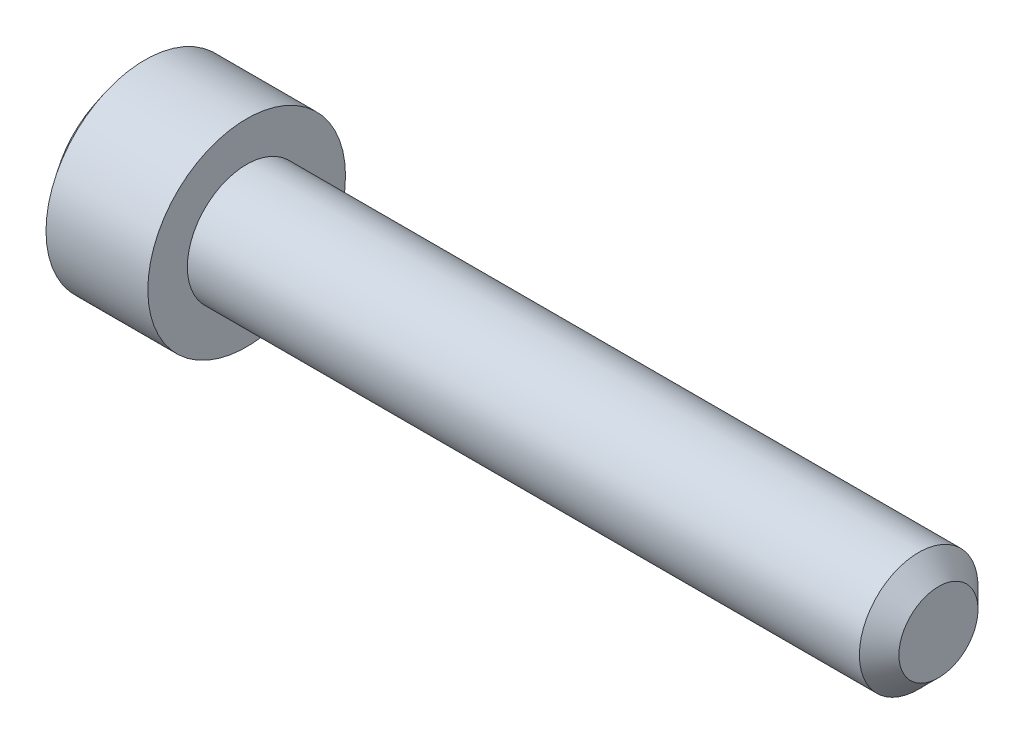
SolidWorks part; units mm, degrees
ref_plane "Plan1" through (0, 0, 0) normal (0, 0, 1) x (1, 0, 0)
ref_plane "Plan2" through (0, 0, 0) normal (0, 1, 0) x (1, 0, 0)
ref_plane "Plan3" through (0, 0, 0) normal (1, 0, 0) x (0, 0, -1)
sketch "Esquisse1" plane through (0, 0, 0) normal (0, 0, 1) x (1, 0, 0)
  line L0 (-28.5762, 0) -> (32.6169, 0) construction
  line L1 (0, 0) -> (0, 3.8686)
  line L2 (0, 3.8686) -> (0.8485, 5)
  line L3 (0.8485, 5) -> (6, 5)
  line L4 (6, 5) -> (6, 3)
  line L5 (6, 3) -> (40, 3)
  line L6 (40, 3) -> (41, 2)
  line L7 (41, 2) -> (41, 0)
  line L8 (41, 0) -> (0, 0)
  dimension "D1" = 1
  dimension "D2" = 1
  dimension "D3" = 6
  dimension "D4" = 35
  dimension "D5" = 5
revolve "Base-Révolution" add sketch "Esquisse1" angle 360 about L0
sketch "Esquisse2" plane through (0, 5.4655, -1.3914) normal (-1, 0, 0) x (0, 0, 1)
  line L4 (-0.5046, -7.6591) -> (-1.508, -5.4655)
  line L5 (2.8032, -7.998) -> (-0.5046, -7.6591)
  line L8 (4.2909, -5.4655) -> (2.8032, -7.998)
  line L9 (-1.508, -5.4655) -> (-0.0203, -2.9329)
  line L11 (-0.0203, -2.9329) -> (3.2874, -3.2718)
  line L13 (3.2874, -3.2718) -> (4.2909, -5.4655)
  dimension "D1" = 5
  dimension "D2" = 4.7509
  dimension "D3" = 5.2734
extrude "Enlèv. mat.-Extru.1" cut sketch "Esquisse2" against normal blind 3
